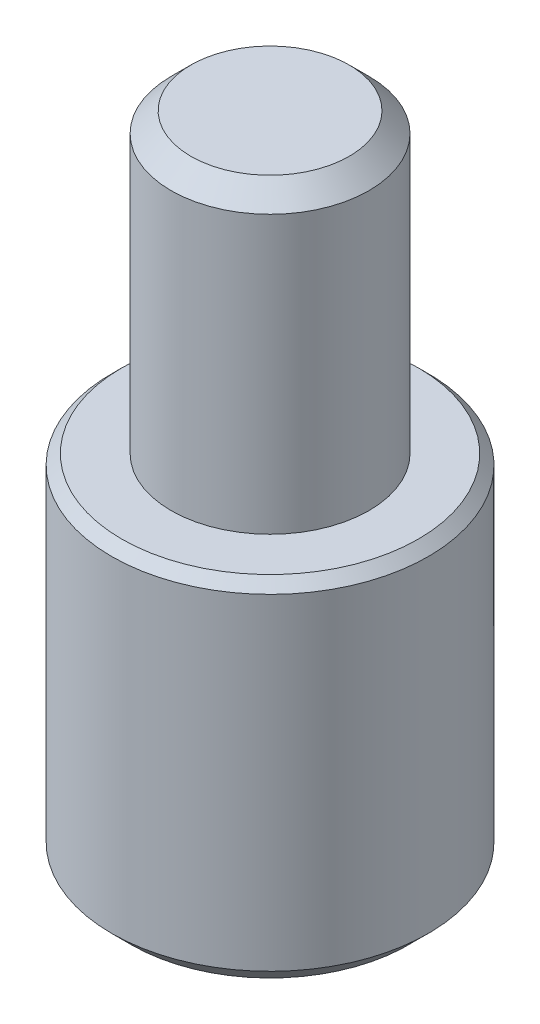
SolidWorks part; units mm, degrees
ref_plane "Front Plane" through (0, 0, 0) normal (0, 0, 1) x (1, 0, 0)
ref_plane "Top Plane" through (0, 0, 0) normal (0, 1, 0) x (1, 0, 0)
ref_plane "Right Plane" through (0, 0, 0) normal (1, 0, 0) x (0, 0, -1)
sketch "Sketch1" plane through (0, 0, 0) normal (0, 1, 0) x (1, 0, 0)
  circle A0 centre (0, 0) radius 4
  dimension "D1" = 8
extrude "Extrude1" add sketch "Sketch1" along normal blind 9
sketch "Sketch2" plane through (0, 9, 0) normal (0, 1, 0) x (1, 0, 0)
  circle A0 centre (0, 0) radius 2.5
  dimension "D1" = 5
extrude "Extrude2" add sketch "Sketch2" along normal blind 7.5
chamfer "Chamfer1" distance 0.254 angle 45 1 edges at (0, 9, 4)
sketch "Sketch3" plane through (0, 0, 0) normal (0, -1, 0) x (1, 0, 0)
  line L1 (0.866, 1.5) -> (-0.866, 1.5)
  line L2 (-0.866, 1.5) -> (-1.7321, 0)
  line L3 (-1.7321, 0) -> (-0.866, -1.5)
  line L4 (-0.866, -1.5) -> (0.866, -1.5)
  line L5 (0.866, -1.5) -> (1.7321, 0)
  line L6 (1.7321, 0) -> (0.866, 1.5)
  circle A0 centre (0, 0) radius 1.5 construction
  dimension "D1" = 3
extrude "Extrude3" cut sketch "Sketch3" against normal blind 3.3
chamfer "Chamfer2" distance 0.5 angle 45 1 edges at (0, 0, 4)
chamfer "Chamfer3" distance 0.5 angle 45 1 edges at (0, 16.5, 2.5)
sketch "Sketch4" plane through (0, 0, 0) normal (0, 0, 1) x (1, 0, 0)
  line L0 (0, 16.5) -> (0, 0) construction
  line L1 (2, 16.5) -> (-2, 16.5) construction
  line L2 (2.5, 10.15) -> (2.37, 10.15)
  line L3 (2.5, 9) -> (2.5, 16) construction
  line L4 (2.37, 10.15) -> (2.37, 9)
  line L5 (3.746, 9) -> (-3.746, 9) construction
  line L6 (2.37, 9) -> (2.5, 9)
  line L7 (2.5, 9) -> (2.5, 10.15)
  dimension "D1" = 1.15
  dimension "D2" = 4.74
